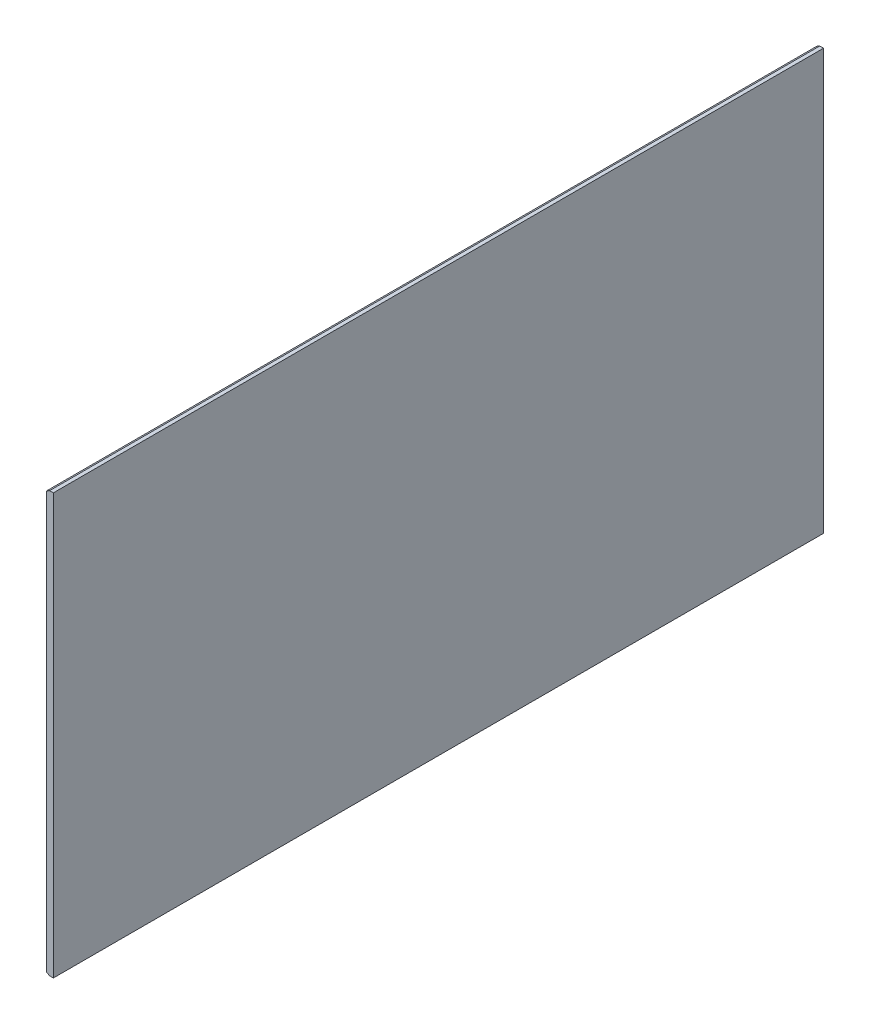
SolidWorks part; units mm, degrees
ref_plane "Front Plane" through (0, 0, 0) normal (1, 0, 0) x (0, 1, 0)
ref_plane "Top Plane" through (0, 0, 0) normal (0, 0, 1) x (0, 1, 0)
ref_plane "Right Plane" through (0, 0, 0) normal (0, 1, 0) x (-1, 0, 0)
sketch "Sketch1" plane through (0, 0, 0) normal (1, 0, 0) x (0, 1, 0)
  line L1 (-579, 1061.35) -> (579, 1061.35)
  line L2 (-579, 1061.35) -> (-579, -1061.35)
  line L3 (-579, -1061.35) -> (579, -1061.35)
  line L4 (579, 1061.35) -> (579, -1061.35)
  line L5 (-579, 1061.35) -> (579, -1061.35) construction
  line L6 (-579, -1061.35) -> (579, 1061.35) construction
  point P0 (0, 0)
  dimension "D1" = 2122.7
  dimension "D2" = 1158
extrude "Boss-Extrude1" add sketch "Sketch1" along normal mid plane 19.05
chamfer "Chamfer1" distance 5 angle 60 2 edges at (-9.525, 579, 0) (-9.525, -579, 0)
